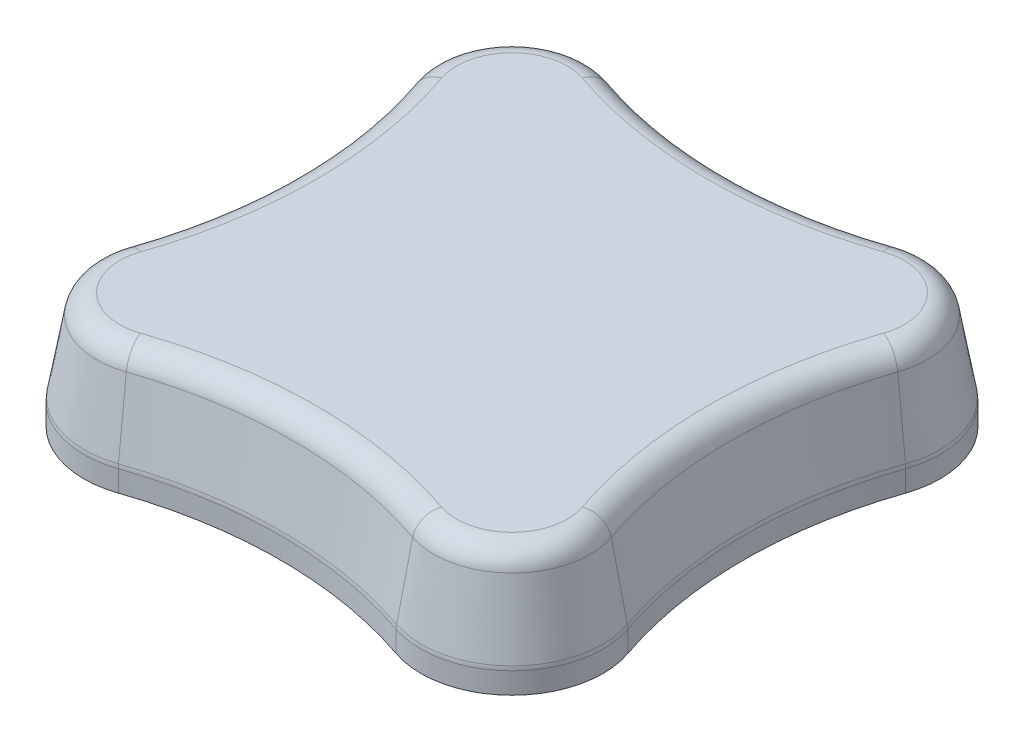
SolidWorks part; units mm, degrees
ref_plane "Front Plane" through (0, 0, 0) normal (0, 0, 1) x (1, 0, 0)
ref_plane "Top Plane" through (0, 0, 0) normal (0, 1, 0) x (1, 0, 0)
ref_plane "Right Plane" through (0, 0, 0) normal (1, 0, 0) x (0, 0, -1)
sketch "Sketch1" plane through (0, 0, 0) normal (0, 1, 0) x (1, 0, 0)
  line L1 (-69.85, -69.85) -> (69.85, -69.85) construction
  line L2 (-69.85, -69.85) -> (-69.85, 69.85) construction
  line L3 (-69.85, 69.85) -> (69.85, 69.85) construction
  line L4 (69.85, -69.85) -> (69.85, 69.85) construction
  line L5 (-69.85, -69.85) -> (69.85, 69.85) construction
  line L6 (-69.85, 69.85) -> (69.85, -69.85) construction
  arc A0 (-38.1, 69.85) -> (38.1, 69.85) centre (0, 180.975) ccw
  arc A1 (69.85, 38.1) -> (69.85, -38.1) centre (180.975, 0) ccw
  arc A2 (38.1, -69.85) -> (-38.1, -69.85) centre (0, -180.975) ccw
  arc A3 (-69.85, -38.1) -> (-69.85, 38.1) centre (-180.975, 0) ccw
  arc A4 (-38.1, 69.85) -> (-69.85, 38.1) centre (-46.2064, 46.2064) ccw
  arc A5 (69.85, 38.1) -> (38.1, 69.85) centre (46.2064, 46.2064) ccw
  arc A6 (38.1, -69.85) -> (69.85, -38.1) centre (46.2064, -46.2064) ccw
  arc A7 (-69.85, -38.1) -> (-38.1, -69.85) centre (-46.2064, -46.2064) ccw
  point P0 (0, 0)
  point P9 (0, 63.5)
  point P22 (0, 0)
  point P33 (0, 0)
  dimension "D2" = 76.2
  dimension "D5" = 4
  dimension "D1" = 139.7
  dimension "D3" = 6.35
  dimension "D4" = 4
extrude "Boss-Extrude1" add sketch "Sketch1" along normal mid plane 6.35
sketch "Sketch2" plane through (0, 3.175, 0) normal (0, 1, 0) x (1, 0, 0)
  arc A8 (-38.1, 69.85) -> (-69.85, 38.1) centre (-46.2064, 46.2064) ccw
  arc A9 (-69.85, -38.1) -> (-69.85, 38.1) centre (-180.975, 0) ccw
  arc A10 (-69.85, -38.1) -> (-38.1, -69.85) centre (-46.2064, -46.2064) ccw
  arc A11 (38.1, -69.85) -> (-38.1, -69.85) centre (0, -180.975) ccw
  arc A12 (38.1, -69.85) -> (69.85, -38.1) centre (46.2064, -46.2064) ccw
  arc A13 (69.85, 38.1) -> (69.85, -38.1) centre (180.975, 0) ccw
  arc A14 (69.85, 38.1) -> (38.1, 69.85) centre (46.2064, 46.2064) ccw
  arc A15 (-38.1, 69.85) -> (38.1, 69.85) centre (0, 180.975) ccw
  arc A16 (-38.1, 69.85) -> (-69.85, 38.1) centre (-46.2064, 46.2064) ccw
  arc A17 (-69.85, -38.1) -> (-69.85, 38.1) centre (-180.975, 0) ccw
  arc A18 (-69.85, -38.1) -> (-38.1, -69.85) centre (-46.2064, -46.2064) ccw
  arc A19 (38.1, -69.85) -> (-38.1, -69.85) centre (0, -180.975) ccw
  arc A20 (38.1, -69.85) -> (69.85, -38.1) centre (46.2064, -46.2064) ccw
  arc A21 (69.85, 38.1) -> (69.85, -38.1) centre (180.975, 0) ccw
  arc A22 (69.85, 38.1) -> (38.1, 69.85) centre (46.2064, 46.2064) ccw
  arc A23 (-38.1, 69.85) -> (38.1, 69.85) centre (0, 180.975) ccw
  dimension "D1" = 0
extrude "Boss-Extrude2" add sketch "Sketch2" along normal blind 25.4 draft 10
fillet "Fillet1" radius 6.35
shell "Shell1" thickness 5.08
sketch "Sketch3" plane through (0, 23.495, 0) normal (0, -1, 0) x (1, 0, 0)
  circle A0 centre (0, 0) radius 29.21
  circle A1 centre (0, 0) radius 25.4
  dimension "D1" = 50.8
  dimension "D2" = 3.81
extrude "Boss-Extrude3" add sketch "Sketch3" along normal blind 19.05
fillet "Fillet2" radius 1.27
